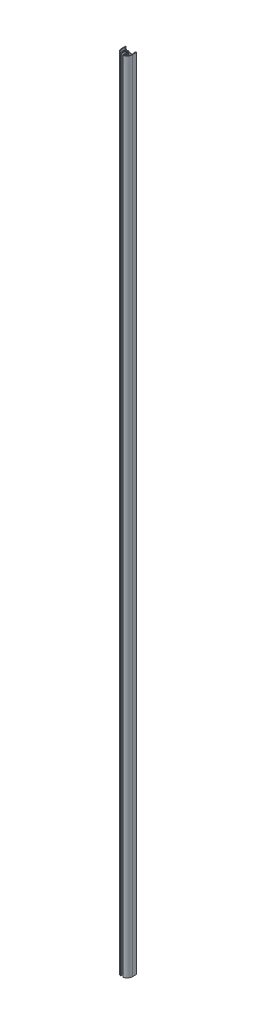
SolidWorks part; units mm, degrees
ref_plane "Ebene vorne" through (0, 0, 0) normal (0, 0, 1) x (1, 0, 0)
ref_plane "Ebene oben" through (0, 0, 0) normal (0, 1, 0) x (1, 0, 0)
ref_plane "Ebene rechts" through (0, 0, 0) normal (1, 0, 0) x (0, 0, -1)
sketch "Skizze1" plane through (0, 0, 0) normal (0, 1, 0) x (1, 0, 0)
  line L0 (-1.2001, 3.6746) -> (-1.2001, 1.2746)
  line L1 (-1.2001, 1.2746) -> (-3.0001, 1.2746)
  line L2 (-3.0001, 1.2746) -> (-3.0001, -2.2754)
  line L3 (-3.0001, -2.2754) -> (-3.2501, -2.5254)
  line L4 (-3.2501, -2.5254) -> (-3.3001, -2.5254)
  line L5 (-3.3001, -2.5254) -> (-3.3001, -9.0254)
  line L6 (-3.3001, -9.0254) -> (-3.2001, -9.0254)
  line L7 (-3.2001, -9.0254) -> (-2.9501, -9.2754)
  line L8 (-2.9501, -9.2754) -> (-2.9501, -12.609)
  line L9 (-15.0001, 1.4746) -> (-15.0001, 12.6004)
  line L10 (-5.4001, 5.8832) -> (-5.4001, 2.4746)
  line L11 (-5.4001, 2.4746) -> (-2.4001, 2.4746)
  line L12 (-2.4001, 2.4746) -> (-2.4001, 4.5811)
  line L13 (2.3999, 4.5811) -> (2.3999, 2.4746)
  line L14 (2.3999, 2.4746) -> (13.4999, 2.4746)
  line L15 (13.4999, 2.4746) -> (13.4999, 8.6498)
  line L16 (13.4999, 8.6498) -> (11.9999, 8.6498)
  line L17 (11.9999, 8.6498) -> (11.9999, 10.1498)
  line L18 (14.9999, 12.6004) -> (14.9999, 1.4746)
  line L19 (2.9499, -12.609) -> (2.9499, -9.2754)
  line L20 (2.9499, -9.2754) -> (3.1999, -9.0254)
  line L21 (3.1999, -9.0254) -> (3.2999, -9.0254)
  line L22 (3.2999, -9.0254) -> (3.2999, -2.5254)
  line L23 (3.2999, -2.5254) -> (2.9999, -2.2754)
  line L24 (2.9999, -2.2754) -> (2.9999, 1.2746)
  line L25 (2.9999, 1.2746) -> (1.1999, 1.2746)
  line L26 (1.1999, 1.2746) -> (1.1999, 3.6746)
  line L27 (1.1999, 3.6746) -> (-1.2001, 3.6746)
  line L28 (-4.3001, -6.0254) -> (-4.3001, -11.3223)
  line L29 (-13.5001, 1.4746) -> (-13.5001, 9.5687)
  line L30 (-6.7001, 4.768) -> (-6.7001, 1.2746)
  line L31 (-6.7001, 1.2746) -> (-4.3001, 1.2746)
  line L32 (-4.3001, 1.2746) -> (-4.3001, -1.0254)
  line L33 (-4.3001, -1.0254) -> (-6.0001, -1.0254)
  line L34 (-6.0001, -6.0254) -> (-4.3001, -6.0254)
  line L35 (4.2999, 1.2746) -> (13.4984, 1.2746)
  line L36 (4.2999, -11.3223) -> (4.2999, -6.0254)
  line L37 (4.2999, -6.0254) -> (5.9999, -6.0254)
  line L38 (4.2999, -1.0254) -> (5.9999, -1.0254)
  line L39 (4.2999, 1.2746) -> (4.2999, -1.0254)
  arc A0 (-2.9501, -12.609) -> (-3.5831, -13.091) centre (-3.4501, -12.609) cw
  arc A1 (-3.5831, -13.091) -> (-15.0001, 1.4746) centre (0.2727, 1.6886) cw
  arc A2 (-15.0001, 12.6004) -> (-14.0736, 12.8614) centre (-14.5001, 12.6004) cw
  arc A3 (-14.0736, 12.8614) -> (-5.4001, 5.8832) centre (-0.0001, 21.4746) ccw
  arc A4 (-2.4001, 4.5811) -> (-1.8442, 5.0779) centre (-1.9001, 4.5811) cw
  arc A5 (-1.8442, 5.0779) -> (1.844, 5.0779) centre (-0.0001, 21.4746) ccw
  arc A6 (1.844, 5.0779) -> (2.3999, 4.5811) centre (1.8999, 4.5811) cw
  arc A7 (11.9999, 10.1498) -> (14.0735, 12.8614) centre (2.444, 19.6056) ccw
  arc A8 (14.0735, 12.8614) -> (14.9999, 12.6004) centre (14.5032, 12.6122) cw
  arc A9 (14.9999, 1.4746) -> (3.5689, -13.0947) centre (-0.0001, 1.4746) cw
  arc A10 (3.5689, -13.0947) -> (2.9499, -12.609) centre (3.4499, -12.609) cw
  arc A11 (-4.3001, -11.3223) -> (-13.5001, 1.4746) centre (0.1835, 1.6065) cw
  arc A12 (-13.5001, 9.5687) -> (-6.7001, 4.768) centre (1.0086, 22.9033) ccw
  arc A13 (-6.0001, -1.0254) -> (-7.6302, -1.63) centre (-6.0001, -3.5254) ccw
  arc A14 (-7.6302, -1.63) -> (-7.3584, -2.617) centre (-7.261, -2.0592) ccw
  arc A15 (-7.3584, -2.617) -> (-7.057, -2.461) centre (-7.4401, -2.0897) ccw
  arc A16 (-7.057, -2.461) -> (-7.045, -4.6015) centre (-6.0026, -3.5254) cw
  arc A17 (-7.6286, -5.4223) -> (-7.3584, -4.4339) centre (-7.2593, -4.9921) cw
  arc A18 (-7.045, -4.6015) -> (-7.3584, -4.4339) centre (-7.4951, -5.0662) ccw
  arc A19 (-7.6286, -5.4223) -> (-6.0001, -6.0254) centre (-6.0001, -3.5254) ccw
  arc A20 (13.4984, 1.2746) -> (4.2999, -11.3223) centre (0.2738, 1.2746) cw
  arc A21 (5.9999, -6.0254) -> (7.63, -5.4209) centre (5.9999, -3.5254) ccw
  arc A22 (7.63, -5.4209) -> (7.3583, -4.4339) centre (7.2608, -4.9916) ccw
  arc A23 (7.0568, -4.5899) -> (7.3583, -4.4339) centre (7.4554, -4.991) cw
  arc A24 (7.0568, -4.5899) -> (7.0582, -2.4624) centre (5.9991, -3.5254) cw
  arc A25 (7.0582, -2.4624) -> (7.3583, -2.617) centre (7.4514, -2.0676) ccw
  arc A26 (5.9999, -1.0254) -> (7.63, -1.63) centre (5.9999, -3.5254) cw
  arc A27 (7.63, -1.63) -> (7.3583, -2.617) centre (7.2608, -2.0592) cw
extrude "Aufsatz-Linear austragen1" add sketch "Skizze1" against normal blind 2200
